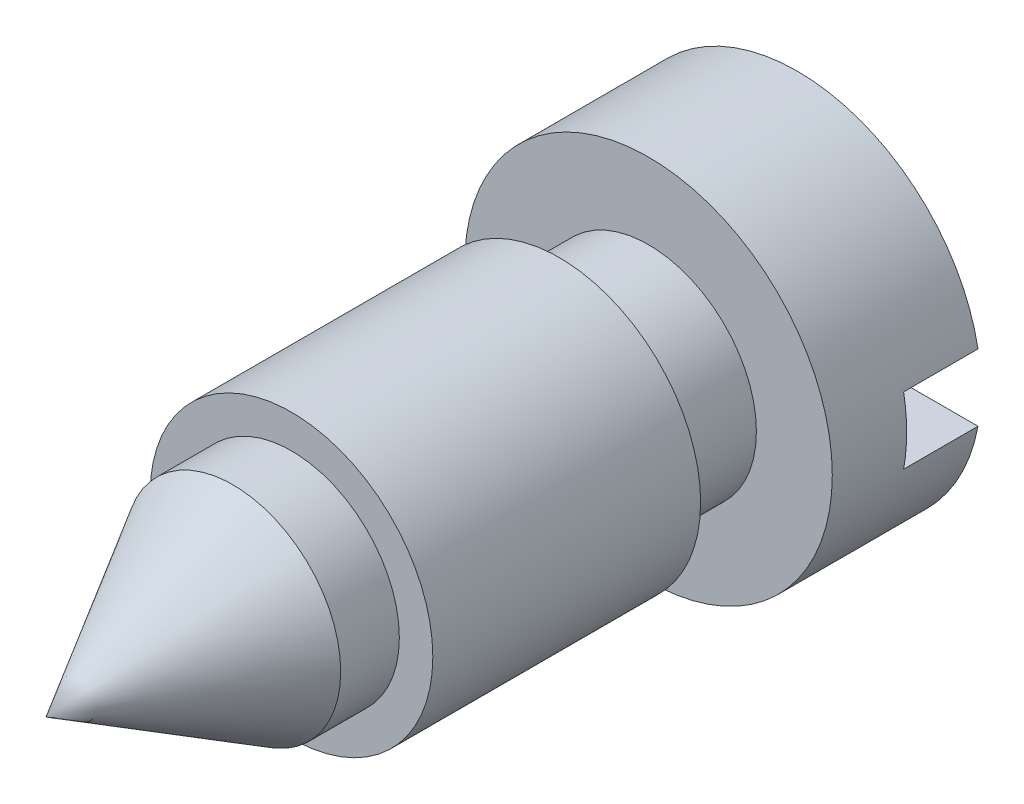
SolidWorks part; units mm, degrees
ref_plane "Спереди" through (0, 0, 0) normal (0, 0, 1) x (1, 0, 0)
ref_plane "Сверху" through (0, 0, 0) normal (0, 1, 0) x (1, 0, 0)
ref_plane "Справа" through (0, 0, 0) normal (1, 0, 0) x (0, 0, -1)
sketch "Эскиз1" plane through (0, 0, 0) normal (1, 0, 0) x (0, 0, -1)
  line L0 (-50.5023, 0) -> (9.7573, 0) construction
  line L1 (0, 0) -> (0, 3.1369)
  line L2 (0, 3.1369) -> (-2.54, 3.1369)
  line L3 (-2.54, 3.1369) -> (-2.54, 1.8415)
  line L4 (-2.54, 1.8415) -> (-4.064, 1.8415)
  line L5 (-4.064, 1.8415) -> (-4.064, 2.413)
  line L6 (-4.064, 2.413) -> (-8.636, 2.413)
  line L7 (-8.636, 2.413) -> (-8.636, 1.8415)
  line L8 (-8.636, 1.8415) -> (-9.6374, 1.8415)
  line L9 (-9.6374, 1.8415) -> (-12.827, 0)
  line L10 (-12.827, 0) -> (0, 0)
  dimension "D1" = 6.2738
  dimension "D2" = 4.826
  dimension "D3" = 3.683
  dimension "D4" = 30
  dimension "D5" = 1.524
  dimension "D6" = 12.827
  dimension "D7" = 4.191
  dimension "D8" = 10.287
revolve "Повернуть1" add sketch "Эскиз1" angle 360 about L0
sketch "Эскиз2" plane through (0, 0, 0) normal (1, 0, 0) x (0, 0, -1)
  line L1 (0, 0.5715) -> (-1.27, 0.5715)
  line L2 (0, 0.5715) -> (0, -0.5715)
  line L3 (0, -0.5715) -> (-1.27, -0.5715)
  line L4 (-1.27, 0.5715) -> (-1.27, -0.5715)
  dimension "D1" = 1.143
  dimension "D2" = 1.27
extrude "Вырез-Вытянуть1" cut sketch "Эскиз2" against normal mid plane 7.62
